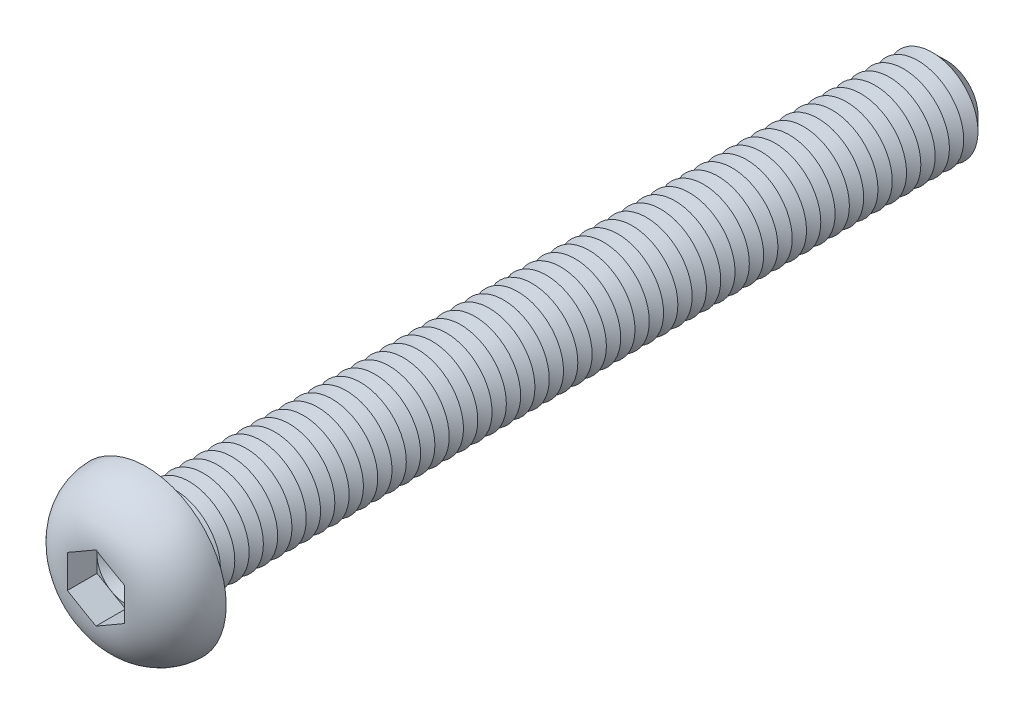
SolidWorks part; units mm, degrees
ref_plane "Front Plane" through (0, 0, 0) normal (0, 0, 1) x (1, 0, 0)
ref_plane "Top Plane" through (0, 0, 0) normal (0, 1, 0) x (1, 0, 0)
ref_plane "Right Plane" through (0, 0, 0) normal (1, 0, 0) x (0, 0, -1)
sketch "Sketch1" plane through (0, 0, 0) normal (1, 0, 0) x (0, 0, -1)
  line L0 (-47.9342, 0) -> (60.3146, 0) construction
sketch "Sketch2" plane through (0, 0, 0) normal (1, 0, 0) x (0, 0, -1)
  line L0 (0, 0) -> (-4.4, 0)
  line L1 (-47.9342, 0) -> (60.3146, 0) construction
  line L2 (-4.4, 0) -> (-4.4, 2.5011)
  line L3 (0, 7) -> (0, 0)
  arc A0 (-4.4, 2.5011) -> (0, 7) centre (0.1, 2.5011) cw
  dimension "D1" = 4.5
  dimension "D2" = 4.4
  dimension "D3" = 7
revolve "Revolve1" add sketch "Sketch2" angle 360 about L0
sketch "Sketch3" plane through (0, 0, 4.4) normal (0, 0, 1) x (1, 0, 0)
  line L1 (0, 2.8868) -> (-2.5, 1.4434)
  line L2 (-2.5, 1.4434) -> (-2.5, -1.4434)
  line L3 (-2.5, -1.4434) -> (0, -2.8868)
  line L4 (0, -2.8868) -> (2.5, -1.4434)
  line L5 (2.5, -1.4434) -> (2.5, 1.4434)
  line L6 (2.5, 1.4434) -> (0, 2.8868)
  circle A0 centre (0, 0) radius 2.5 construction
  dimension "D1" = 5
extrude "Cut-Extrude1" cut sketch "Sketch3" against normal blind 2.6
sketch "Sketch4" plane through (0, 0, 0) normal (0, 0, -1) x (-1, 0, 0)
  circle A0 centre (0, 0) radius 4
  dimension "D1" = 8
extrude "Boss-Extrude1" add sketch "Sketch4" along normal blind 70
chamfer "Chamfer1" distance 1.25 angle 45 1 edges at (-4, 0, -70)
sketch "Sketch5" plane through (0, 0, 0) normal (1, 0, 0) x (0, 0, -1)
  line L0 (1.25, 4) -> (2.5, 4)
  line L1 (68.75, 4) -> (0, 4) construction
  line L2 (2.5, 4) -> (1.875, 2.9175)
  line L3 (1.875, 2.9175) -> (1.25, 4)
  line L4 (0, -7) -> (0, 7) construction
  line L5 (68.75, 4) -> (0, 4) construction
  dimension "D1" = 1.25
  dimension "D2" = 1.25
revolve "Cut-Revolve1" cut sketch "Sketch5" angle 360 about L0
pattern_linear "LPattern1" count 54 spacing 1.25 along (0, 0, -1) of "Cut-Revolve1"
fillet "Fillet2" radius 0.5 1 edges at (4, 0, 0)
sketch "Sketch6" plane through (0, 0, 1.8) normal (0, 0, 1) x (1, 0, 0)
  line L0 (0, -2.8868) -> (2.5, -1.4434) construction
  circle A0 centre (0, 0) radius 2.5
extrude "Cut-Extrude2" cut sketch "Sketch6" against normal through all draft 60
